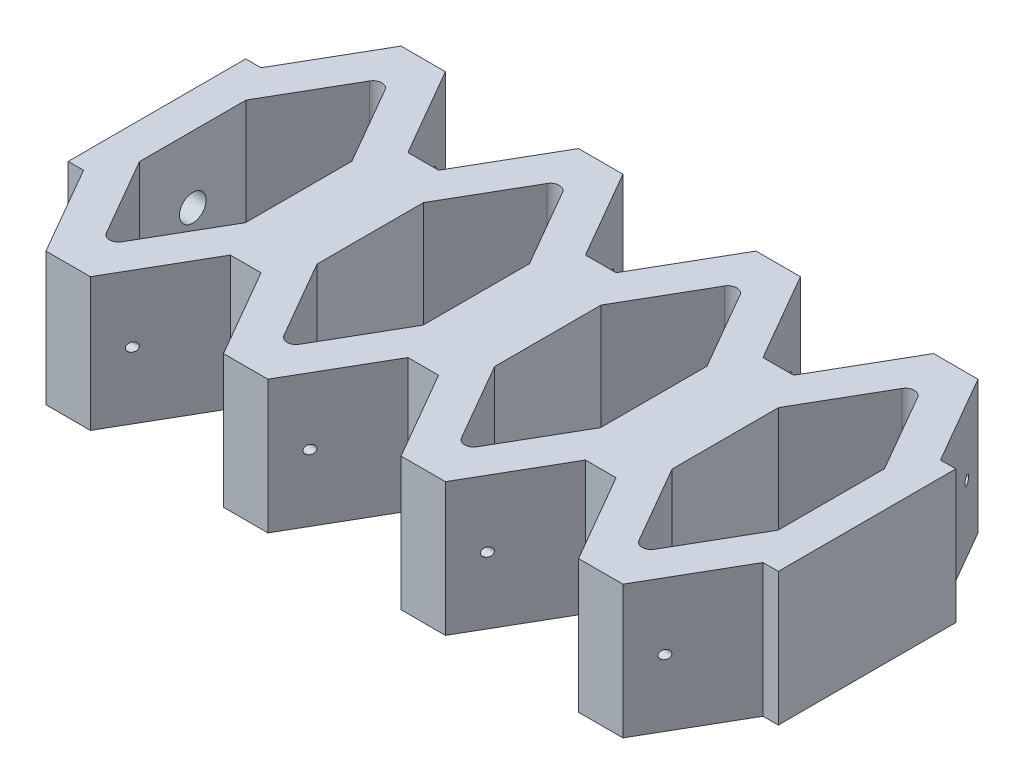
SolidWorks part; units mm, degrees
ref_plane "Front" through (0, 0, 0) normal (0, 0, 1) x (1, 0, 0)
ref_plane "Top" through (0, 0, 0) normal (0, 1, 0) x (1, 0, 0)
ref_plane "Right" through (0, 0, 0) normal (1, 0, 0) x (0, 0, -1)
sketch "Sketch1" plane through (0, 0, 0) normal (0, 1, 0) x (1, 0, 0)
  line L0 (0, 10) -> (1.7265, 10)
  line L1 (1.7265, 10) -> (7.5, 20)
  line L2 (7.5, 20) -> (12.5, 20)
  line L3 (12.5, 20) -> (18.2735, 10)
  line L4 (4.0359, 6) -> (9.134, 14.8301)
  line L5 (10.866, 14.8301) -> (15.9641, 6)
  line L6 (0, 0) -> (48.6312, 0) construction
  line L7 (15.9641, 6) -> (15.9641, -6)
  line L8 (4.0359, 6) -> (4.0359, -6)
  line L9 (0, 10) -> (0, -10)
  line L10 (10.866, -14.8301) -> (15.9641, -6)
  line L11 (4.0359, -6) -> (9.134, -14.8301)
  line L12 (12.5, -20) -> (18.2735, -10)
  line L13 (7.5, -20) -> (12.5, -20)
  line L14 (1.7265, -10) -> (7.5, -20)
  line L15 (0, -10) -> (1.7265, -10)
  line L16 (10, 20) -> (10, -20) construction
  line L18 (18.2735, 10) -> (20, 10)
  line L19 (20, 10) -> (20, -10)
  line L20 (20, -10) -> (18.2735, -10)
  arc A0 (10.866, -14.8301) -> (9.134, -14.8301) centre (10, -14.3301) cw
  arc A1 (10.866, 14.8301) -> (9.134, 14.8301) centre (10, 14.3301) ccw
  point P15 (10, -16.3301)
  point P19 (4.0359, 0)
  point P20 (15.9641, 0)
  point P26 (10, 16.3301)
  point P31 (20, -10)
  point P32 (15.575, 6)
  point P33 (0, 0)
  point P34 (15.2695, -6)
  dimension "D8" = 1
  dimension "D1" = 20
  dimension "D2" = 5
  dimension "D3" = 120
  dimension "D4" = 40
  dimension "D5" = 20
  dimension "D6" = 4
  dimension "D7" = 4
extrude "Boss-Extrude1" add sketch "Sketch1" along normal blind 15
pattern_linear "LPattern1" count 4 spacing 20 along (1, 0, 0) of "Boss-Extrude1"
sketch "Sketch2" plane through (0, 0, 0) normal (1, 0, 0) x (0, 0, -1)
  line L0 (0, 0) -> (0, 15) construction
  line L1 (10, 0) -> (-10, 0) construction
  line L2 (10, 15) -> (-10, 15) construction
  line L3 (0, 7.5) -> (17, 7.5) construction
  circle A0 centre (17, 7.5) radius 0.5
  circle A1 centre (-17, 7.5) radius 0.5
  point P9 (17, 5.2997)
  point P11 (16.2331, 4.8739)
  dimension "D1" = 1
  dimension "D2" = 17
extrude "Cut-Extrude1" cut sketch "Sketch2" along normal through all
sketch "Sketch3" plane through (0, 0, 0) normal (-1, 0, 0) x (0, 0, 1)
  line L0 (0, 0) -> (0, 15) construction
  line L1 (-10, 15) -> (10, 15) construction
  circle A0 centre (0, 7.5) radius 1.5
  point P7 (0, 0)
  dimension "D1" = 3
extrude "Cut-Extrude2" cut sketch "Sketch3" against normal up to next
